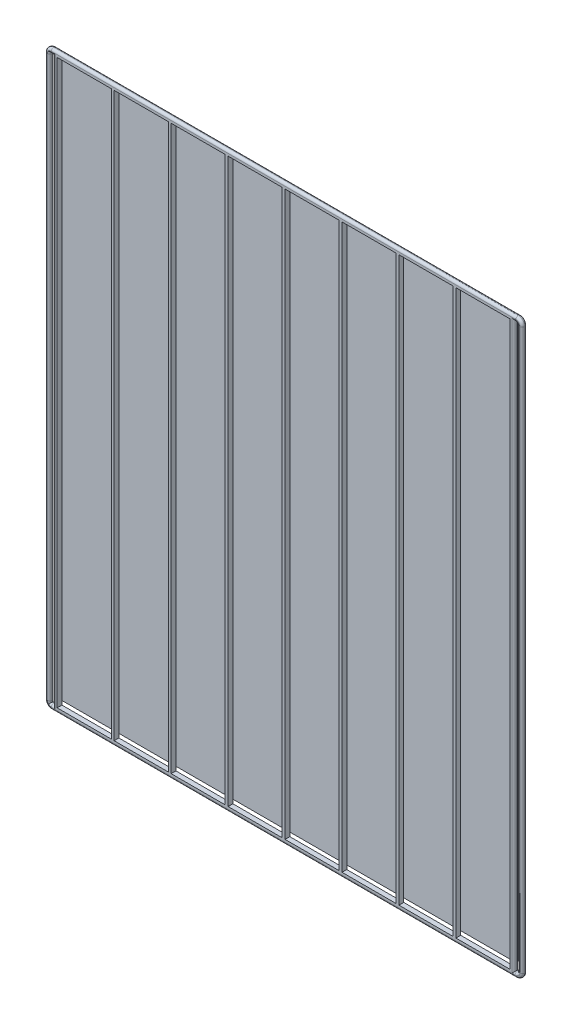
SolidWorks part; units mm, degrees
ref_plane "Plan de face" through (0, 0, 0) normal (0, 0, 1) x (1, 0, 0)
ref_plane "Plan de dessus" through (0, 0, 0) normal (0, 1, 0) x (1, 0, 0)
ref_plane "Plan de droite" through (0, 0, 0) normal (1, 0, 0) x (0, 0, -1)
sketch "Esquisse1" plane through (0, 0, 0) normal (0, 0, 1) x (1, 0, 0)
  line L2 (0, 0) -> (750, 0)
  line L3 (0, 0) -> (0, 900)
  line L4 (0, 900) -> (750, 900)
  line L5 (750, 0) -> (750, 900)
  dimension "D1" = 900
  dimension "D2" = 750
extrude "Extrusion1" add sketch "Esquisse1" along normal blind 7.5
fillet "Congé1" radius 10 4 edges at (0, 0, 3.75) (0, 900, 3.75) (750, 0, 3.75) (750, 900, 3.75)
fillet "Congé2" radius 3.75 16 edges at (2.9289, 897.0711, 7.5) (375, 900, 7.5) (747.0711, 897.0711, 7.5) (750, 450, 7.5) (747.0711, 2.9289, 7.5) (375, 0, 7.5) (2.9289, 2.9289, 7.5) (747.0711, 897.0711, 0) (750, 450, 0) (747.0711, 2.9289, 0) (375, 0, 0) (2.9289, 2.9289, 0) (0, 450, 0) (2.9289, 897.0711, 0) (0, 450, 7.5) (375, 900, 0)
sketch "Esquisse2" plane through (0, 0, 0) normal (0, 0, -1) x (-1, 0, 0)
  line L0 (-746.25, 890) -> (-746.25, 10) construction
  line L1 (-742.5, 7.5) -> (-737.5, 7.5)
  line L2 (-742.5, 7.5) -> (-742.5, 892.5)
  line L3 (-742.5, 892.5) -> (-737.5, 892.5)
  line L4 (-737.5, 7.5) -> (-737.5, 892.5)
  line L5 (-10, 896.25) -> (-740, 896.25) construction
  line L6 (-740, 3.75) -> (-10, 3.75) construction
  dimension "D1" = 5
  dimension "D2" = 3.75
  dimension "D3" = 3.75
  dimension "D4" = 3.75
extrude "Extrusion2" cut sketch "Esquisse2" against normal blind 7.5
fillet "Congé3" radius 3.75 8 edges at (740, 892.5, 7.5) (740, 7.5, 7.5) (740, 7.5, 0) (737.5, 450, 0) (740, 892.5, 0) (742.5, 450, 0) (737.5, 450, 7.5) (742.5, 450, 7.5)
sketch "Esquisse3" plane through (0, 0, 0) normal (0, 0, -1) x (-1, 0, 0)
  line L0 (-10, 896.25) -> (-733.75, 896.25) construction
  line L1 (-7.5, 7.5) -> (-12.5, 7.5)
  line L2 (-7.5, 7.5) -> (-7.5, 892.5)
  line L3 (-7.5, 892.5) -> (-12.5, 892.5)
  line L4 (-12.5, 7.5) -> (-12.5, 892.5)
  line L5 (-3.75, 10) -> (-3.75, 890) construction
  line L6 (-733.75, 3.75) -> (-10, 3.75) construction
  dimension "D1" = 5
  dimension "D2" = 3.75
  dimension "D3" = 3.75
  dimension "D4" = 3.75
extrude "Extrusion3" cut sketch "Esquisse3" against normal blind 7.5
fillet "Congé4" radius 3.75 8 edges at (12.5, 450, 7.5) (10, 892.5, 7.5) (7.5, 450, 7.5) (10, 7.5, 7.5) (10, 892.5, 0) (12.5, 450, 0) (10, 7.5, 0) (7.5, 450, 0)
sketch "Esquisse4" plane through (0, 0, 0) normal (0, 0, -1) x (-1, 0, 0)
  line L0 (-16.25, 896.25) -> (-733.75, 896.25) construction
  line L1 (-645.75, 7.5) -> (-730.75, 7.5)
  line L2 (-645.75, 7.5) -> (-645.75, 892.5)
  line L3 (-645.75, 892.5) -> (-730.75, 892.5)
  line L4 (-730.75, 7.5) -> (-730.75, 892.5)
  line L5 (-733.75, 3.75) -> (-16.25, 3.75) construction
  line L6 (-733.75, 896.25) -> (-733.75, 3.75) construction
  dimension "D1" = 85
  dimension "D2" = 3.75
  dimension "D3" = 3.75
  dimension "D4" = 3
extrude "Extrusion4" cut sketch "Esquisse4" against normal blind 7.5
pattern_linear "Répétition linéaire4" count 8 spacing 89.5 along (-1, 0, 0) of "Extrusion4"
sketch "Esquisse5" plane through (0, 0, 0) normal (0, 0, -1) x (-1, 0, 0)
  line L0 (-16.25, 3.75) -> (-16.25, 896.25) construction
  line L1 (-17.75, 886.25) -> (-732.25, 886.25)
  line L2 (-17.75, 886.25) -> (-17.75, 13.75)
  line L3 (-17.75, 13.75) -> (-732.25, 13.75)
  line L4 (-732.25, 886.25) -> (-732.25, 13.75)
  line L5 (-16.25, 896.25) -> (-733.75, 896.25) construction
  line L6 (-733.75, 3.75) -> (-16.25, 3.75) construction
  line L7 (-733.75, 896.25) -> (-733.75, 3.75) construction
  dimension "D1" = 1.5
  dimension "D2" = 10
  dimension "D3" = 10
  dimension "D4" = 1.5
extrude "Extrusion5" add sketch "Esquisse5" along normal blind 4.5
